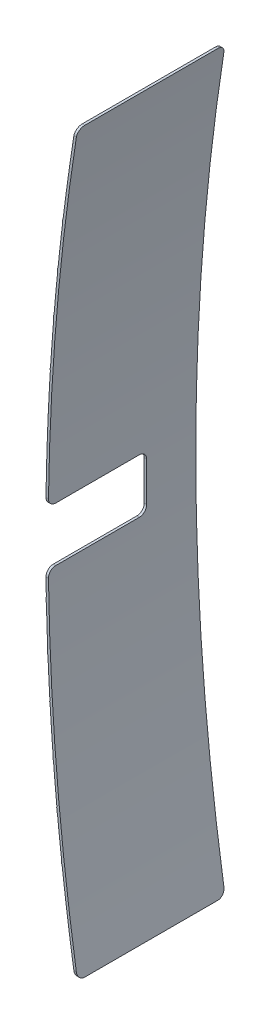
SolidWorks part; units mm, degrees
ref_plane "前视基准面" through (0, 0, 0) normal (0, 0, 1) x (1, 0, 0)
ref_plane "上视基准面" through (0, 0, 0) normal (0, 1, 0) x (1, 0, 0)
ref_plane "右视基准面" through (0, 0, 0) normal (1, 0, 0) x (0, 0, -1)
sketch "草图1" plane through (0, 0, 0) normal (0, 0, 1) x (1, 0, 0)
  line L0 (-93.9096, 15) -> (-93.8083, 15)
  line L1 (-93.9096, -15) -> (-93.8083, -15)
  line L2 (-1000, 0) -> (49000, 0) construction
  arc A0 (-93.9096, 15) -> (-93.9096, -15) centre (0, 0) ccw
  arc A1 (-93.8083, 15) -> (-93.8083, -15) centre (0, 0) ccw
  dimension "D1" = 190.2
  dimension "D2" = 190
  dimension "D3" = 30
extrude "凸台-拉伸1" add sketch "草图1" along normal blind 6
ref_plane "基准面1" through (-50, 0, 0) normal (1, 0, 0) x (0, 0, -1)
sketch "草图4" plane through (0, 0, 0) normal (1, 0, 0) x (0, 0, -1)
  line L0 (-6, -1.1) -> (-2, -1.1)
  line L1 (-6, 15) -> (-6, -15) construction
  line L2 (-2, -1.1) -> (-2, 1.1)
  line L3 (-2, 1.1) -> (-6, 1.1)
  line L4 (-6, 1.1) -> (-6, -1.1)
  line L5 (-1000, 0) -> (49000, 0) construction
  dimension "D1" = 4
  dimension "D2" = 2.2
extrude "切除-拉伸1" cut sketch "草图4" against normal through all
fillet "圆角1" radius 0.3 8 edges at (-93.8589, -15, 6) (-93.8589, -15, 0) (-93.8589, 15, 6) (-93.8589, 15, 0) (-95.0436, -1.1, 2) (-95.0436, 1.1, 2) (-95.0436, 1.1, 6) (-95.0436, -1.1, 6)
sketch "草图5" plane through (-50, 0, 0) normal (1, 0, 0) x (0, 0, -1)
  line L0 (0, -2.8572) -> (0, 3.1428)
  line L1 (0, 3.1428) -> (-2, 0.1428)
  line L2 (-2, 0.1428) -> (0, -2.8572)
  line L3 (-1002, 0.1428) -> (48998, 0.1428) construction
  line L4 (0, -14.7) -> (0, 14.7) construction
  line L5 (-2, 0.8) -> (-2, -0.8) construction
  line L6 (-6, -1.4) -> (-6, -14.7) construction
  line L7 (-6, -2.3) -> (-2, -2.3)
  line L8 (-6, -2.3) -> (-6, -2.1)
  line L9 (-6, -2.1) -> (-2, -2.1)
  line L10 (-2, -2.3) -> (-2, -2.1)
  line L31 (-5.7, -1.1) -> (-2.3, -1.1) construction
  line L56 (-6, -4.1) -> (-2, -4.1)
  line L57 (-6, -4.1) -> (-6, -3.9)
  line L58 (-6, -3.9) -> (-2, -3.9)
  line L59 (-2, -4.1) -> (-2, -3.9)
  line L60 (-6, -5.9) -> (-2, -5.9)
  line L61 (-6, -5.9) -> (-6, -5.7)
  line L62 (-6, -5.7) -> (-2, -5.7)
  line L63 (-2, -5.9) -> (-2, -5.7)
  line L64 (-6, -7.7) -> (-2, -7.7)
  line L65 (-6, -7.7) -> (-6, -7.5)
  line L66 (-6, -7.5) -> (-2, -7.5)
  line L67 (-2, -7.7) -> (-2, -7.5)
  line L68 (-6, -9.5) -> (-2, -9.5)
  line L69 (-6, -9.5) -> (-6, -9.3)
  line L70 (-6, -9.3) -> (-2, -9.3)
  line L71 (-2, -9.5) -> (-2, -9.3)
  line L72 (-6, -11.3) -> (-2, -11.3)
  line L73 (-6, -11.3) -> (-6, -11.1)
  line L74 (-6, -11.1) -> (-2, -11.1)
  line L75 (-2, -11.3) -> (-2, -11.1)
  line L76 (-6, -2.3) -> (-6, -4.1) construction
  line L77 (-6, 2.5855) -> (-6, 4.3855) construction
  line L78 (-2, 11.5855) -> (-2, 11.3855)
  line L79 (-6, 11.3855) -> (-2, 11.3855)
  line L80 (-6, 11.5855) -> (-6, 11.3855)
  line L81 (-6, 11.5855) -> (-2, 11.5855)
  line L82 (-2, 9.7855) -> (-2, 9.5855)
  line L83 (-6, 9.5855) -> (-2, 9.5855)
  line L84 (-6, 9.7855) -> (-6, 9.5855)
  line L85 (-6, 9.7855) -> (-2, 9.7855)
  line L86 (-2, 7.9855) -> (-2, 7.7855)
  line L87 (-6, 7.7855) -> (-2, 7.7855)
  line L88 (-6, 7.9855) -> (-6, 7.7855)
  line L89 (-6, 7.9855) -> (-2, 7.9855)
  line L90 (-2, 6.1855) -> (-2, 5.9855)
  line L91 (-6, 5.9855) -> (-2, 5.9855)
  line L92 (-6, 6.1855) -> (-6, 5.9855)
  line L93 (-6, 6.1855) -> (-2, 6.1855)
  line L94 (-2, 4.3855) -> (-2, 4.1855)
  line L95 (-6, 4.1855) -> (-2, 4.1855)
  line L96 (-6, 4.3855) -> (-6, 4.1855)
  line L97 (-6, 4.3855) -> (-2, 4.3855)
  line L98 (-2, 2.5855) -> (-2, 2.3855)
  line L99 (-6, 2.3855) -> (-2, 2.3855)
  line L100 (-6, 2.5855) -> (-6, 2.3855)
  line L101 (-6, 2.5855) -> (-2, 2.5855)
  line L116 (-5.7, 15) -> (-0.3, 15) construction
  line L117 (-4.8, 13.5) -> (-3.65, 13.5)
  line L118 (-4.8, 13.5) -> (-4.8, 13.3)
  line L119 (-4.8, 13.3) -> (-3.65, 13.3)
  line L120 (-2.3, 13.5) -> (-2.3, 13.3)
  line L121 (-6, 14.7) -> (-6, 1.4) construction
  line L122 (-3.65, 14.65) -> (-3.45, 14.65)
  line L123 (-3.65, 14.65) -> (-3.65, 13.5)
  line L124 (-3.65, 12.15) -> (-3.45, 12.15)
  line L125 (-3.45, 14.65) -> (-3.45, 13.5)
  line L126 (-5.7, -15) -> (-0.3, -15) construction
  line L127 (-3.65, -12.15) -> (-3.45, -12.15)
  line L128 (-3.65, -12.15) -> (-3.65, -14.65)
  line L129 (-3.65, -14.65) -> (-3.45, -14.65)
  line L130 (-3.45, -12.15) -> (-3.45, -14.65)
  line L131 (-3.45, 13.3) -> (-3.45, 12.15)
  line L132 (-3.45, 13.5) -> (-2.3, 13.5)
  line L133 (-3.65, 13.3) -> (-3.65, 12.15)
  line L134 (-3.45, 13.3) -> (-2.3, 13.3)
  point P81 (-3.65, -13.4)
  dimension "D1" = 6
  dimension "D2" = 0.2
  dimension "D3" = 6
  dimension "D5" = 1
  dimension "D4" = 1.8
  dimension "D6" = 2.5
  dimension "D7" = 0.2
  dimension "D8" = 1.5
  dimension "D9" = 2.5
  dimension "D10" = 0.2
  dimension "D11" = 1.15
  dimension "D12" = 1.15
  dimension "D13" = 1.2
  dimension "D14" = 2.5
  dimension "D15" = 0.2
  dimension "D16" = 0.35
  dimension "D17" = 2.35
wrap "包覆1" sketch "草图5" wrap type emboss source sketch "草图5" thickness 0.01 parameters "D1"=0.01
